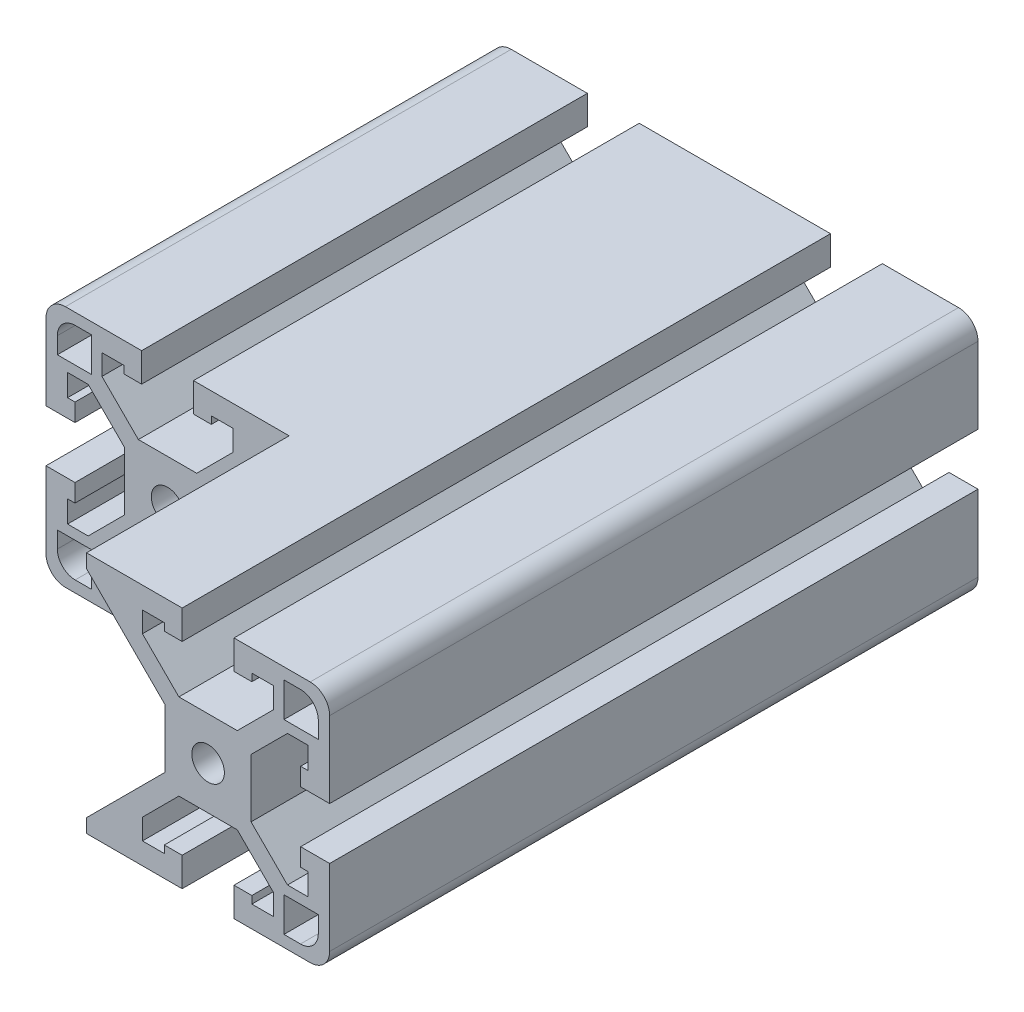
SolidWorks part; units mm, degrees
ref_plane "Front" through (0, 0, 0) normal (0, 0, 1) x (1, 0, 0)
ref_plane "Top" through (0, 0, 0) normal (0, 1, 0) x (1, 0, 0)
ref_plane "Right" through (0, 0, 0) normal (1, 0, 0) x (0, 0, -1)
sketch "Sketch1" plane through (0, 0, 0) normal (0, 0, 1) x (1, 0, 0)
  line L0 (-12.319, 4.5757) -> (-12.319, -4.5757)
  line L1 (0, 16.8947) -> (-12.319, 4.5757)
  line L2 (12.319, 4.5757) -> (0, 16.8947)
  line L3 (12.319, -4.5757) -> (12.319, 4.5757)
  line L4 (0, -16.8947) -> (12.319, -4.5757)
  line L5 (-12.319, -4.5757) -> (0, -16.8947)
  line L6 (-30.9372, 11.8872) -> (-30.9372, 17.272)
  line L7 (-36.322, 11.8872) -> (-30.9372, 11.8872)
  line L8 (-36.322, 14.478) -> (-36.322, 11.8872)
  line L9 (-30.9372, 17.272) -> (-33.528, 17.272)
  line L10 (-30.9372, -17.272) -> (-30.9372, -11.8872)
  line L11 (-33.528, -17.272) -> (-30.9372, -17.272)
  line L12 (-36.322, -11.8872) -> (-36.322, -14.478)
  line L13 (-30.9372, -11.8872) -> (-36.322, -11.8872)
  line L14 (36.322, -11.8872) -> (30.9372, -11.8872)
  line L15 (36.322, -14.478) -> (36.322, -11.8872)
  line L16 (30.9372, -17.272) -> (33.528, -17.272)
  line L17 (30.9372, -11.8872) -> (30.9372, -17.272)
  line L18 (30.9372, 17.272) -> (30.9372, 11.8872)
  line L19 (33.528, 17.272) -> (30.9372, 17.272)
  line L20 (36.322, 11.8872) -> (36.322, 14.478)
  line L21 (30.9372, 11.8872) -> (36.322, 11.8872)
  line L22 (-29.337, 12.4423) -> (-29.337, 15.6718)
  line L23 (-29.337, 15.6718) -> (-25.908, 15.6718)
  line L24 (-25.908, 15.6718) -> (-25.908, 14.5034)
  line L25 (-25.908, 14.5034) -> (-23.114, 14.5034)
  line L26 (-23.114, 14.5034) -> (-23.114, 19.05)
  line L27 (-23.114, 19.05) -> (-35.052, 19.05)
  line L28 (-38.1, 16.002) -> (-38.1, 4.064)
  line L29 (-38.1, 4.064) -> (-33.5534, 4.064)
  line L30 (-33.5534, 4.064) -> (-33.5534, 6.858)
  line L31 (-33.5534, 6.858) -> (-34.7218, 6.858)
  line L32 (-34.7218, 6.858) -> (-34.7218, 10.287)
  line L33 (-34.7218, 10.287) -> (-31.4923, 10.287)
  line L34 (-31.4923, 10.287) -> (-25.781, 4.5757)
  line L35 (-25.781, 4.5757) -> (-25.781, -4.5757)
  line L36 (-25.781, -4.5757) -> (-31.4923, -10.287)
  line L37 (-31.4923, -10.287) -> (-34.7218, -10.287)
  line L38 (-34.7218, -10.287) -> (-34.7218, -6.858)
  line L39 (-34.7218, -6.858) -> (-33.5534, -6.858)
  line L40 (-33.5534, -6.858) -> (-33.5534, -4.064)
  line L41 (-33.5534, -4.064) -> (-38.1, -4.064)
  line L42 (-38.1, -4.064) -> (-38.1, -16.002)
  line L43 (-35.052, -19.05) -> (-23.114, -19.05)
  line L44 (-23.114, -19.05) -> (-23.114, -14.5034)
  line L45 (-23.114, -14.5034) -> (-25.908, -14.5034)
  line L46 (-25.908, -14.5034) -> (-25.908, -15.6718)
  line L47 (-25.908, -15.6718) -> (-29.337, -15.6718)
  line L48 (-29.337, -15.6718) -> (-29.337, -12.4423)
  line L49 (-29.337, -12.4423) -> (-23.6257, -6.731)
  line L50 (-23.6257, -6.731) -> (-14.4743, -6.731)
  line L51 (-14.4743, -6.731) -> (-8.763, -12.4423)
  line L52 (-8.763, -12.4423) -> (-8.763, -15.6718)
  line L53 (-8.763, -15.6718) -> (-12.192, -15.6718)
  line L54 (-12.192, -15.6718) -> (-12.192, -14.5034)
  line L55 (-12.192, -14.5034) -> (-14.986, -14.5034)
  line L56 (-14.986, -14.5034) -> (-14.986, -19.05)
  line L57 (-14.986, -19.05) -> (14.986, -19.05)
  line L58 (14.986, -19.05) -> (14.986, -14.5034)
  line L59 (14.986, -14.5034) -> (12.192, -14.5034)
  line L60 (12.192, -14.5034) -> (12.192, -15.6718)
  line L61 (12.192, -15.6718) -> (8.763, -15.6718)
  line L62 (8.763, -15.6718) -> (8.763, -12.4423)
  line L63 (8.763, -12.4423) -> (14.4743, -6.731)
  line L64 (14.4743, -6.731) -> (23.6257, -6.731)
  line L65 (23.6257, -6.731) -> (29.337, -12.4423)
  line L66 (29.337, -12.4423) -> (29.337, -15.6718)
  line L67 (29.337, -15.6718) -> (25.908, -15.6718)
  line L68 (25.908, -15.6718) -> (25.908, -14.5034)
  line L69 (25.908, -14.5034) -> (23.114, -14.5034)
  line L70 (23.114, -14.5034) -> (23.114, -19.05)
  line L71 (23.114, -19.05) -> (35.052, -19.05)
  line L72 (38.1, -16.002) -> (38.1, -4.064)
  line L73 (38.1, -4.064) -> (33.5534, -4.064)
  line L74 (33.5534, -4.064) -> (33.5534, -6.858)
  line L75 (33.5534, -6.858) -> (34.7218, -6.858)
  line L76 (34.7218, -6.858) -> (34.7218, -10.287)
  line L77 (34.7218, -10.287) -> (31.4923, -10.287)
  line L78 (31.4923, -10.287) -> (25.781, -4.5757)
  line L79 (25.781, -4.5757) -> (25.781, 4.5757)
  line L80 (25.781, 4.5757) -> (31.4923, 10.287)
  line L81 (31.4923, 10.287) -> (34.7218, 10.287)
  line L82 (34.7218, 10.287) -> (34.7218, 6.858)
  line L83 (34.7218, 6.858) -> (33.5534, 6.858)
  line L84 (33.5534, 6.858) -> (33.5534, 4.064)
  line L85 (33.5534, 4.064) -> (38.1, 4.064)
  line L86 (38.1, 4.064) -> (38.1, 16.002)
  line L87 (35.052, 19.05) -> (23.114, 19.05)
  line L88 (23.114, 19.05) -> (23.114, 14.5034)
  line L89 (23.114, 14.5034) -> (25.908, 14.5034)
  line L90 (25.908, 14.5034) -> (25.908, 15.6718)
  line L91 (25.908, 15.6718) -> (29.337, 15.6718)
  line L92 (29.337, 15.6718) -> (29.337, 12.4423)
  line L93 (29.337, 12.4423) -> (23.6257, 6.731)
  line L94 (23.6257, 6.731) -> (14.4743, 6.731)
  line L95 (14.4743, 6.731) -> (8.763, 12.4423)
  line L96 (8.763, 12.4423) -> (8.763, 15.6718)
  line L97 (8.763, 15.6718) -> (12.192, 15.6718)
  line L98 (12.192, 15.6718) -> (12.192, 14.5034)
  line L99 (12.192, 14.5034) -> (14.986, 14.5034)
  line L100 (14.986, 14.5034) -> (14.986, 19.05)
  line L101 (14.986, 19.05) -> (-14.986, 19.05)
  line L102 (-14.986, 19.05) -> (-14.986, 14.5034)
  line L103 (-14.986, 14.5034) -> (-12.192, 14.5034)
  line L104 (-12.192, 14.5034) -> (-12.192, 15.6718)
  line L105 (-12.192, 15.6718) -> (-8.763, 15.6718)
  line L106 (-8.763, 15.6718) -> (-8.763, 12.4423)
  line L107 (-8.763, 12.4423) -> (-14.4743, 6.731)
  line L108 (-14.4743, 6.731) -> (-23.6257, 6.731)
  line L109 (-23.6257, 6.731) -> (-29.337, 12.4423)
  circle A0 centre (-19.05, 0) radius 2.5527
  circle A1 centre (19.05, 0) radius 2.5527
  arc A2 (-35.052, 19.05) -> (-38.1, 16.002) centre (-35.052, 16.002) ccw
  arc A3 (-38.1, -16.002) -> (-35.052, -19.05) centre (-35.052, -16.002) ccw
  arc A4 (35.052, -19.05) -> (38.1, -16.002) centre (35.052, -16.002) ccw
  arc A5 (38.1, 16.002) -> (35.052, 19.05) centre (35.052, 16.002) ccw
  arc A6 (-33.528, 17.272) -> (-36.322, 14.478) centre (-33.528, 14.478) ccw
  arc A7 (-36.322, -14.478) -> (-33.528, -17.272) centre (-33.528, -14.478) ccw
  arc A8 (33.528, -17.272) -> (36.322, -14.478) centre (33.528, -14.478) ccw
  arc A9 (36.322, 14.478) -> (33.528, 17.272) centre (33.528, 14.478) ccw
extrude "Boss-Extrude1" add sketch "Sketch1" along normal mid plane 101.6
sketch "Sketch2" plane through (0, 0, 50.8) normal (0, 0, 1) x (1, 0, 0)
  line L0 (14.986, 19.05) -> (-14.986, 19.05) construction
  line L1 (-38.1, 19.05) -> (0, 19.05)
  line L2 (-38.1, 19.05) -> (-38.1, -19.05)
  line L3 (-38.1, -19.05) -> (0, -19.05)
  line L4 (0, 19.05) -> (0, -19.05)
  line L5 (-23.114, 19.05) -> (-35.052, 19.05) construction
  line L6 (-38.1, 16.002) -> (-38.1, 4.064) construction
  line L7 (-14.986, -19.05) -> (14.986, -19.05) construction
  point P6 (0, 19.05)
extrude "Cut-Extrude1" cut sketch "Sketch2" against normal offset from surface (31.75 mm away) 69.85
